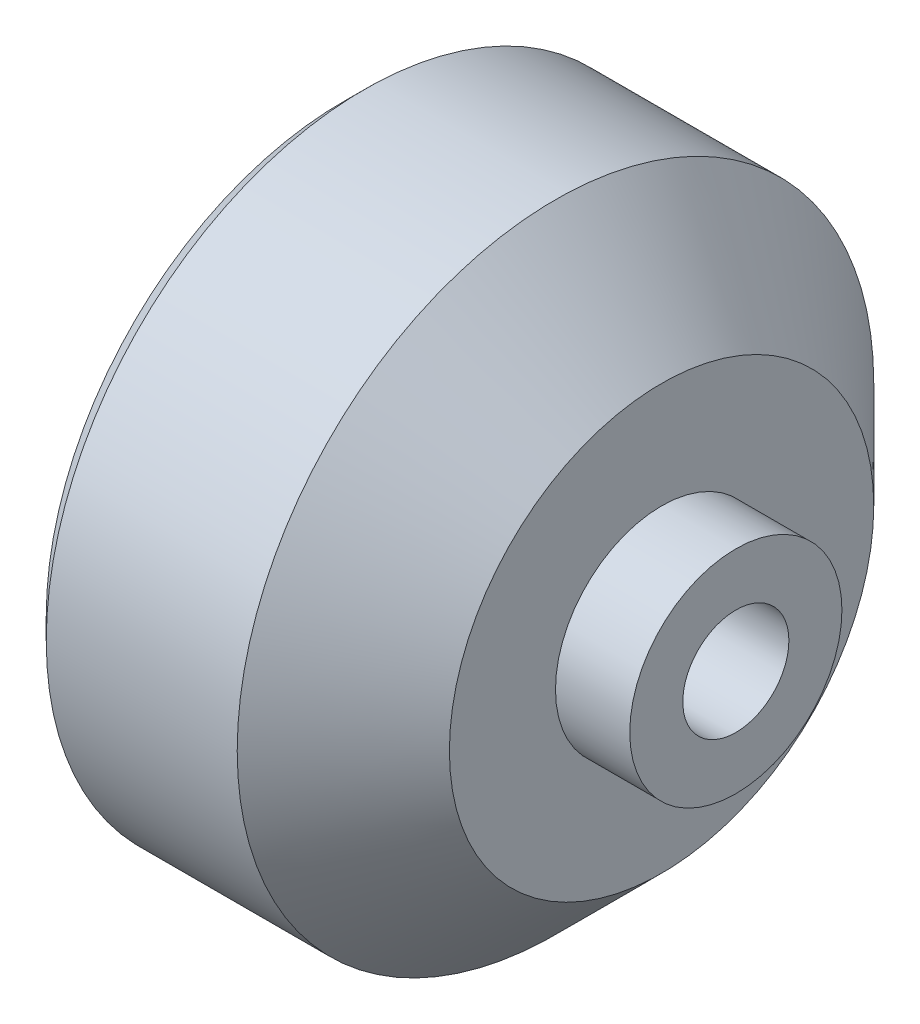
SolidWorks part; units mm, degrees
ref_plane "Front" through (0, 0, 0) normal (0, 0, 1) x (1, 0, 0)
ref_plane "Top" through (0, 0, 0) normal (0, 1, 0) x (1, 0, 0)
ref_plane "Right" through (0, 0, 0) normal (1, 0, 0) x (0, 0, -1)
sketch "Sketch1" plane through (0, 0, 0) normal (0, 1, 0) x (1, 0, 0)
  line L0 (0, 0) -> (18.5, 0)
  line L1 (18.5, 0) -> (18.5, 5)
  line L2 (18.5, 5) -> (15, 5)
  line L3 (15, 5) -> (15, 10)
  line L4 (10, 15) -> (1, 15)
  line L5 (0, 14) -> (0, 0)
  line L8 (1, 15) -> (0, 14)
  line L9 (10, 15) -> (15, 10)
revolve "Revolve1" add sketch "Sketch1" angle 360 about L0
sketch "Sketch2" plane through (18.5, 0, 0) normal (1, 0, 0) x (0, 0, -1)
  circle A0 centre (0, 0) radius 2.5
extrude "Cut-Extrude1" cut sketch "Sketch2" against normal through all
